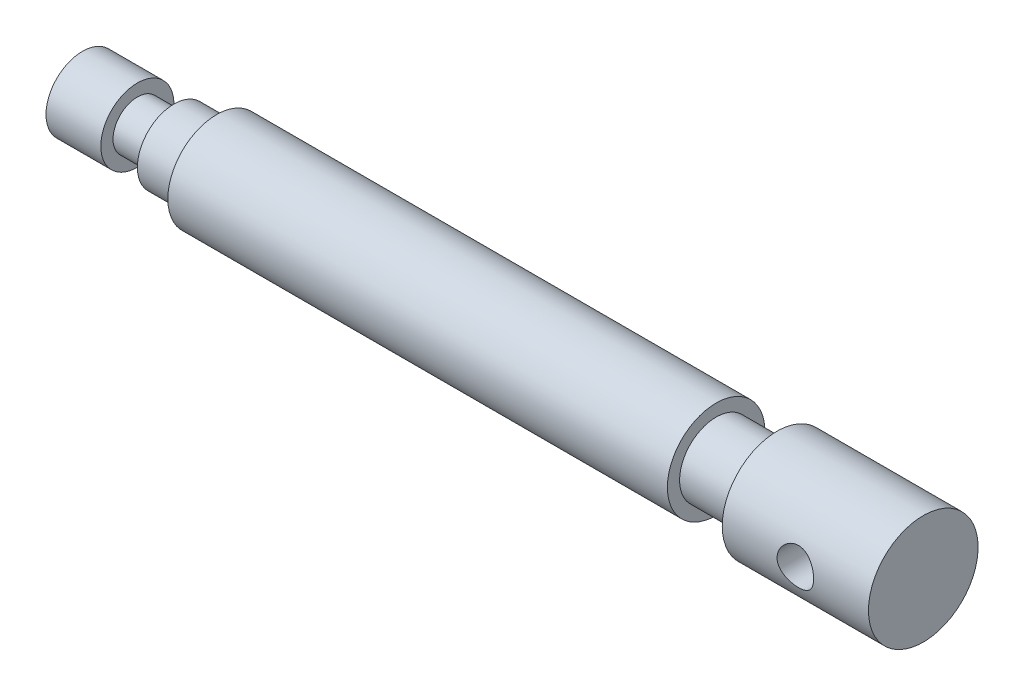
SolidWorks part; units mm, degrees
ref_plane "Front Plane" through (0, 0, 0) normal (0, 0, 1) x (1, 0, 0)
ref_plane "Top Plane" through (0, 0, 0) normal (0, 1, 0) x (1, 0, 0)
ref_plane "Right Plane" through (0, 0, 0) normal (1, 0, 0) x (0, 0, -1)
sketch "Sketch1" plane through (0, 0, 0) normal (0, 0, 1) x (1, 0, 0)
  line L0 (-25.1903, 0) -> (0, 0) construction
  line L1 (0, 0) -> (0, 6)
  line L2 (0, 6) -> (9, 6)
  line L3 (9, 6) -> (9, 4)
  line L4 (9, 4) -> (15, 4)
  line L5 (15, 4) -> (15, 6)
  line L6 (15, 6) -> (22, 6)
  line L7 (22, 6) -> (22, 8)
  line L8 (22, 8) -> (104, 8)
  line L9 (104, 8) -> (104, 6)
  line L10 (104, 6) -> (114, 6)
  line L11 (114, 6) -> (114, 9)
  line L12 (114, 9) -> (138, 9)
  line L13 (138, 9) -> (138, 0)
  line L14 (138, 0) -> (0, 0)
  dimension "D1" = 9
  dimension "D2" = 6
  dimension "D3" = 82
  dimension "D4" = 10
  dimension "D5" = 24
  dimension "D6" = 12
  dimension "D7" = 8
  dimension "D8" = 16
  dimension "D9" = 18
  dimension "D10" = 138
revolve "Revolve1" add sketch "Sketch1" angle 360 about L0
sketch "Sketch2" plane through (0, 0, 0) normal (0, 0, 1) x (1, 0, 0)
  line L0 (138, -9) -> (138, 9) construction
  circle A0 centre (126, 0) radius 3
  dimension "D1" = 6
  dimension "D2" = 12
extrude "Cut-Extrude1" cut sketch "Sketch2" against normal mid plane 30
